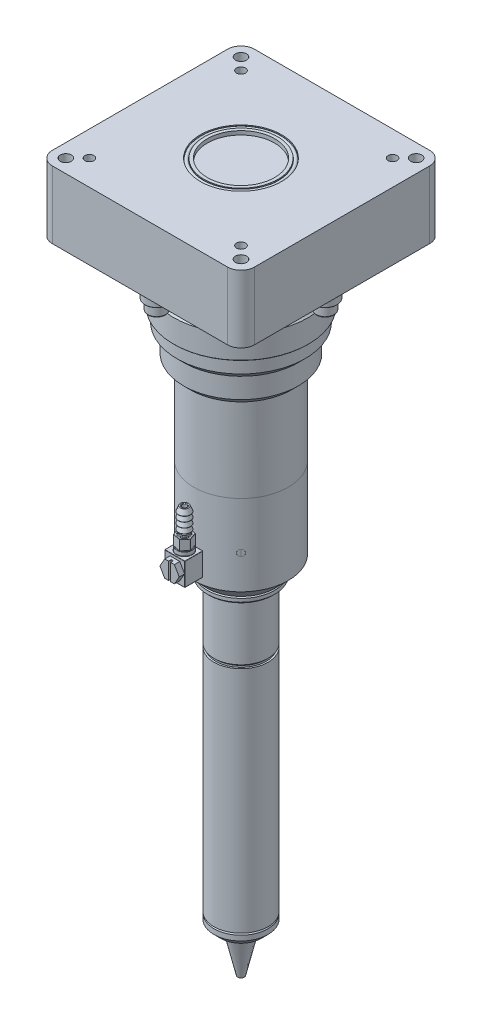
SolidWorks part; units mm, degrees
ref_plane "Front Plane" through (0, 0, 0) normal (0, 0, 1) x (1, 0, 0)
ref_plane "Top Plane" through (0, 0, 0) normal (0, 1, 0) x (1, 0, 0)
ref_plane "Right Plane" through (0, 0, 0) normal (1, 0, 0) x (0, 0, -1)
imported_body "Defeatured1"
hole_wizard "CBORE for M5 SHCS1" positions "Sketch1" profile "Sketch2" counterbore size "M5" standard "HAAS"
sketch "Sketch1" plane through (0, 0, 0) normal (0, -1, 0) x (-1, 0, 0)
  line L0 (0, 0) -> (60.1324, 0) construction
  line L2 (0, 0) -> (0, -52.2004) construction
  point P0 (-41.275, 41.275)
  point P16 (41.275, 41.275)
  point P17 (41.275, -41.275)
  point P18 (-41.275, -41.275)
  dimension "D1" = 41.275
  dimension "D2" = 41.275
sketch "Sketch2" plane through (41.275, 0, -41.275) normal (1, 0, 0) x (0, 0, -1)
  line L0 (0, 0) -> (0, 31.75)
  line L1 (0, 31.75) -> (2.6035, 31.75)
  line L3 (2.6035, 31.75) -> (2.6035, 5.334)
  line L4 (2.6035, 5.334) -> (4.3561, 5.334)
  line L5 (4.3561, 5.334) -> (4.3561, 0)
  line L7 (4.3561, 0) -> (0, 0)
  line L11 (0, -6.35) -> (0, 107.95) construction
  dimension "Thru Hole Dia." = 5.207
  dimension "Thru Hole Depth" = 31.75
  dimension "C'Bore Dia." = 8.7122
  dimension "C'Bore Depth" = 5.334
